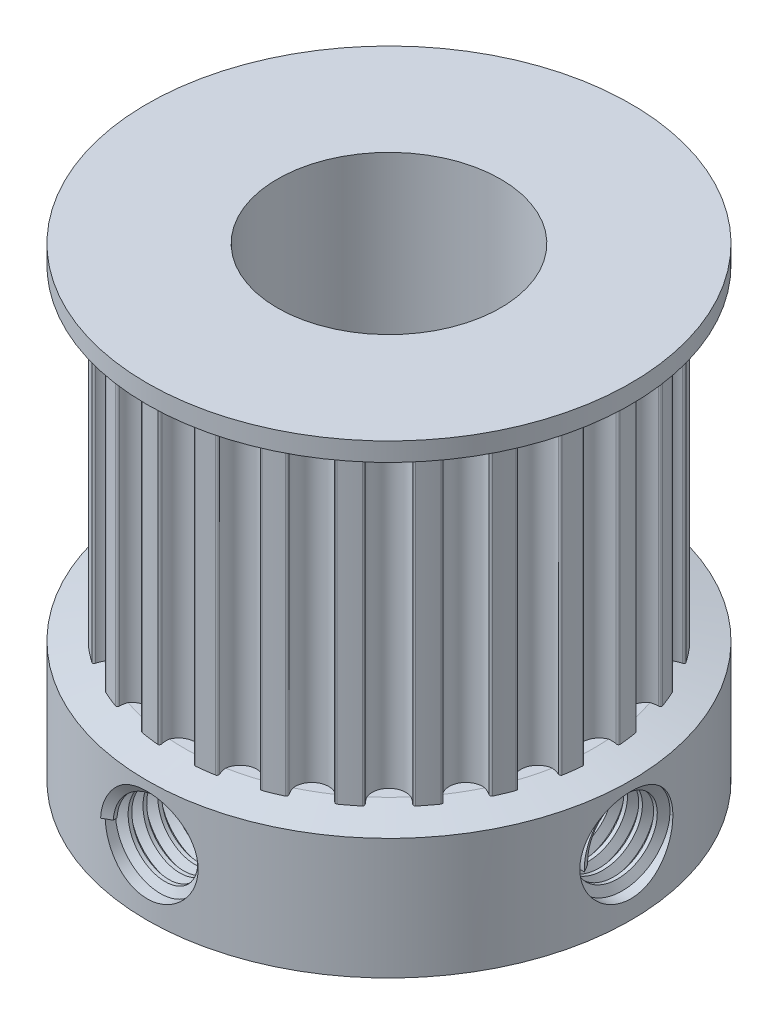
SolidWorks part; units mm, degrees
ref_plane "Спереди" through (0, 0, 0) normal (0, 0, 1) x (1, 0, 0)
ref_plane "Сверху" through (0, 0, 0) normal (0, 1, 0) x (1, 0, 0)
ref_plane "Справа" through (0, 0, 0) normal (1, 0, 0) x (0, 0, -1)
sketch "Эскиз1" plane through (0, 0, 0) normal (0, 1, 0) x (1, 0, 0)
  circle A0 centre (0, 0) radius 10.2892 construction
  circle A1 centre (0, 0) radius 11.4592
extrude "Бобышка-Вытянуть1" add sketch "Эскиз1" along normal blind 16.5
sketch "Эскиз2" plane through (0, 0, 0) normal (0, 1, 0) x (1, 0, 0)
  line L0 (-1.0126, 11.4143) -> (0, 13.9867)
  line L1 (0, 13.9867) -> (1.0126, 11.4143)
  line L2 (0, 0) -> (0, 11.4592) construction
  arc A0 (1.0126, 11.4143) -> (0.9, 11.3087) centre (1.0058, 11.3087) ccw
  arc A1 (0.9, 11.3087) -> (-0.9, 11.3087) centre (0, 11.3087) cw
  arc A2 (-0.9, 11.3087) -> (-1.0126, 11.4143) centre (-1.0058, 11.3087) ccw
  circle A3 centre (0, 0) radius 11.4592 construction
  dimension "D1" = 0.2117
  dimension "D2" = 1.8
  dimension "D3" = 1.0126
  dimension "D4" = 2.5724
  dimension "D5" = 1.0126
  dimension "D6" = 2.5724
  dimension "D7" = 1.8
extrude "Вырез-Вытянуть1" cut sketch "Эскиз2" along normal through all contours A1 A2 L0 L1 A0
pattern_circular "Круговой массив1" count 24 over 360 about axis through (0, 0, 0) along (0, 1, 0) of "Вырез-Вытянуть1"
sketch "Эскиз4" plane through (0, 0, 0) normal (0, 1, 0) x (1, 0, 0)
  circle A0 centre (0, 0) radius 13
  dimension "D1" = 26
extrude "Бобышка-Вытянуть2" add sketch "Эскиз4" against normal blind 7
sketch "Эскиз5" plane through (0, 16.5, 0) normal (0, 1, 0) x (1, 0, 0)
  circle A0 centre (0, 0) radius 13
  dimension "D1" = 26
extrude "Бобышка-Вытянуть3" add sketch "Эскиз5" along normal blind 1.5
sketch "Эскиз6" plane through (0, 0, 0) normal (0, 1, 0) x (1, 0, 0)
  circle A0 centre (0, 0) radius 6
  dimension "D1" = 12
extrude "Вырез-Вытянуть2" cut sketch "Эскиз6" along normal blind 18 and the other way through all
chamfer "Фаска1" distance 0.5 distance2 2 1 edges at (0, 0, 13)
chamfer "Фаска2" distance 2 distance2 0.5 1 edges at (0, 16.5, 13)
ref_plane "Плоскость1" through (0, 0, 13) normal (0, 0, 1) x (1, 0, 0)
sketch "Эскиз7" plane through (0, 0, 13) normal (0, 0, 1) x (1, 0, 0)
  line L0 (11.4592, 0) -> (-11.4592, 0) construction
  line L1 (-13, -0.5) -> (-13, -7) construction
  circle A0 centre (0, -3.5) radius 2.5
  dimension "D1" = 5
  dimension "D2" = 3.5
  dimension "D3" = 13
extrude "Вырез-Вытянуть3" cut sketch "Эскиз7" against normal up to next
thread "Резьба1" pitch 0.8 start angle 0, offset 0, length 6.5, pitch 0.8, diameter 5
ref_plane "Плоскость2" through (-2.5, -3.5, 13) normal (0, -1, 0) x (-1, 0, 0)
sketch "Профиль резьбы1" plane through (-2.5, -3.5, 13) normal (0, -1, 0) x (-1, 0, 0)
  line L0 (0, 0) -> (0, 0.8) construction
  line L11 (0, 0) -> (0, 0.7)
  line L12 (0, 0.7) -> (-0.433, 0.45)
  line L13 (-0.433, 0.45) -> (-0.433, 0.25)
  line L15 (-0.433, 0.25) -> (0, 0)
  line L17 (-0.433, 0.35) -> (0, 0.35) construction
  point P2 (0, 0)
  dimension "Pitch" = 0.8
  dimension "Profile_Angle" = 60
  dimension "Profile_Land" = 0.2
  dimension "Profile_Height" = 0.433
ref_plane "Плоскость3" through (13, 0, 0) normal (1, 0, 0) x (0, 0, -1)
sketch "Эскиз10" plane through (13, 0, 0) normal (1, 0, 0) x (0, 0, -1)
  line L0 (11.4592, 0) -> (-11.4592, 0) construction
  line L1 (13, -7) -> (13, -0.5) construction
  circle A0 centre (0, -3.5) radius 2.5
  dimension "D1" = 5
  dimension "D2" = 3.5
  dimension "D3" = 13
extrude "Вырез-Вытянуть4" cut sketch "Эскиз10" against normal up to next
thread "Резьба2" pitch 0.8 start angle 0, offset 0, length 6.5, pitch 0.8, diameter 5
ref_plane "Плоскость4" through (13, -3.5, 2.5) normal (0, -1, 0) x (0, 0, 1)
sketch "Профиль резьбы2" plane through (13, -3.5, 2.5) normal (0, -1, 0) x (0, 0, 1)
  line L0 (0, 0) -> (0, 0.8) construction
  line L11 (0, 0) -> (0, 0.7)
  line L12 (0, 0.7) -> (-0.433, 0.45)
  line L13 (-0.433, 0.45) -> (-0.433, 0.25)
  line L15 (-0.433, 0.25) -> (0, 0)
  line L17 (-0.433, 0.35) -> (0, 0.35) construction
  point P2 (0, 0)
  dimension "Pitch" = 0.8
  dimension "Profile_Angle" = 60
  dimension "Profile_Land" = 0.2
  dimension "Profile_Height" = 0.433
equation "\"Модуль\"= 3мм"
equation "\"Количество зубьев\"= 24"
equation "\"D1@Эскиз1\" = \"Модуль\" * \"Количество зубьев\" / pi - \"Высота зуба\" * 2"
equation "\"D2@Эскиз1\"= \"Модуль\" * \"Количество зубьев\" / pi"
equation "\"Высота зуба\"= 1.17"
equation "\"D1@Круговой массив1\"=\"Количество зубьев\""
